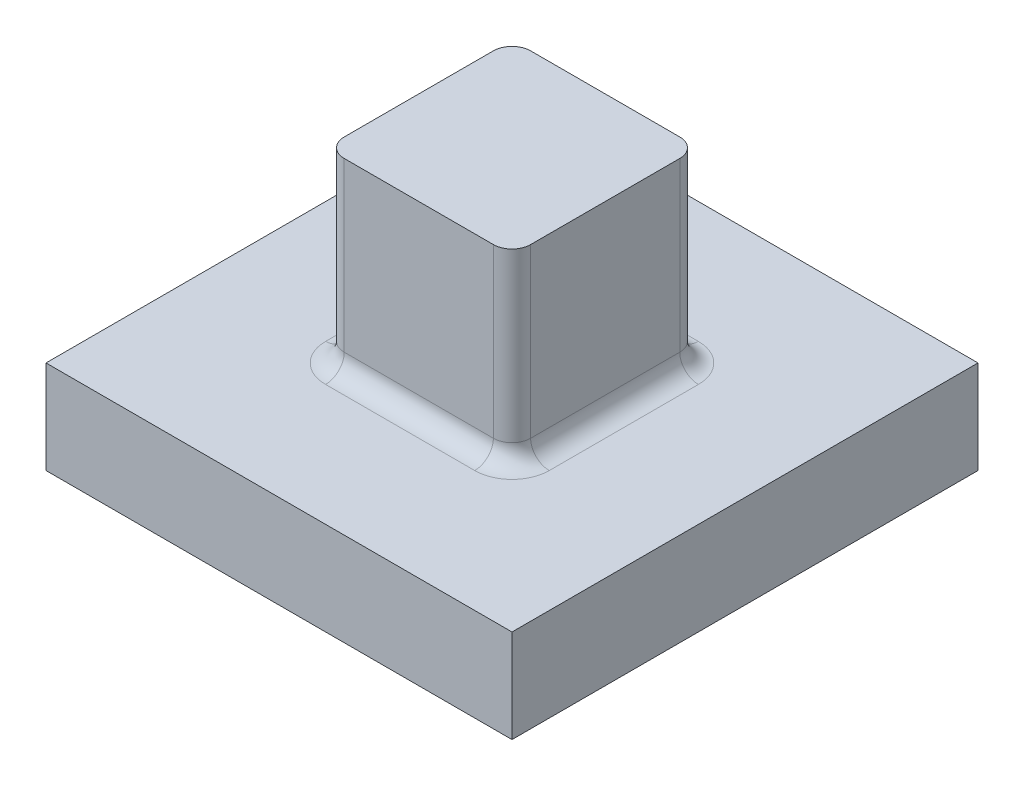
SolidWorks part; units mm, degrees
ref_plane "Front Plane" through (0, 0, 0) normal (0, 0, 1) x (1, 0, 0)
ref_plane "Top Plane" through (0, 0, 0) normal (0, 1, 0) x (1, 0, 0)
ref_plane "Right Plane" through (0, 0, 0) normal (1, 0, 0) x (0, 0, -1)
sketch "Sketch1" plane through (0, 0, 0) normal (0, 1, 0) x (1, 0, 0)
  line L1 (0, 0) -> (-50, 0)
  line L2 (0, 0) -> (0, 50)
  line L3 (0, 50) -> (-50, 50)
  line L4 (-50, 0) -> (-50, 50)
  dimension "D1" = 50
  dimension "D2" = 50
extrude "Extrude1" add sketch "Sketch1" along normal blind 30
sketch "Sketch2" plane through (0, 30, 0) normal (0, 1, 0) x (-1, 0, 0)
  line L8 (15, -15) -> (15, -35)
  line L9 (15, -35) -> (35, -35)
  line L10 (35, -35) -> (35, -15)
  line L11 (35, -15) -> (15, -15)
  line L12 (15, -15) -> (15, -35)
  line L13 (15, -35) -> (35, -35)
  line L14 (35, -35) -> (35, -15)
  line L15 (35, -15) -> (15, -15)
  dimension "D1" = 15
extrude "Cut-Extrude1" cut sketch "Sketch2" against normal blind 20 flip side to cut
fillet "Fillet1" radius 2 8 edges at (-25, 10, -15) (-35, 20, -15) (-35, 10, -25) (-35, 20, -35) (-25, 10, -35) (-15, 20, -35) (-15, 10, -25) (-15, 20, -15)
